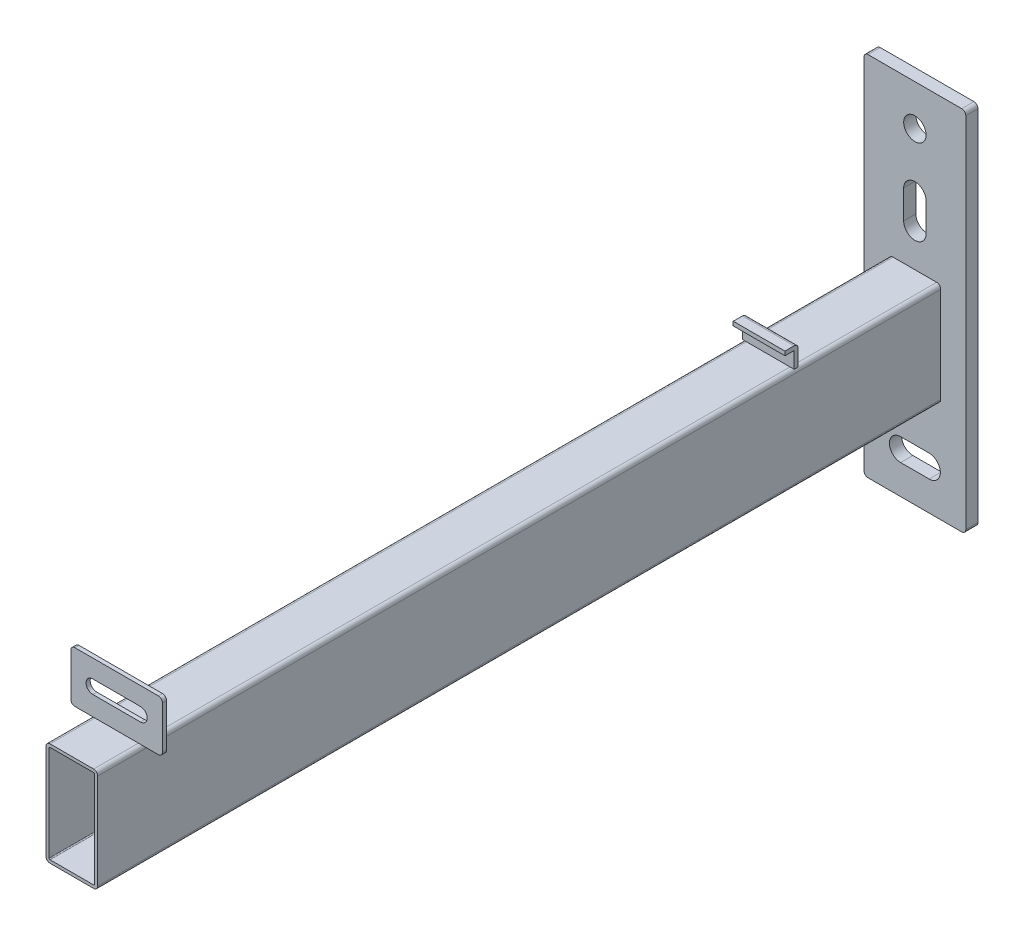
SolidWorks part; units mm, degrees
ref_plane "Front Plane" through (0, 0, 0) normal (0, 0, 1) x (1, 0, 0)
ref_plane "Top Plane" through (0, 0, 0) normal (0, 1, 0) x (1, 0, 0)
ref_plane "Right Plane" through (0, 0, 0) normal (1, 0, 0) x (0, 0, -1)
sketch "Sketch2" plane through (0, 0, 0) normal (1, 0, 0) x (0, 0, -1)
  line L0 (0, 0) -> (-420, 0)
  dimension "D1" = 420
other "Structural Member1"
ref_plane "Plane1" through (0, 0, 0) normal (0, 0, 1) x (1, 0, 0)
sketch "Sketch14" plane through (0, 0, 0) normal (0, 0, 1) x (1, 0, 0)
  line L0 (-10.7, -23.9) -> (10.7, -23.9)
  line L1 (-11.2, -23.4) -> (-11.2, 23.4)
  line L2 (10.7, 23.9) -> (-10.7, 23.9)
  line L3 (11.2, 23.4) -> (11.2, -23.4)
  line L4 (-10.7, -25.4) -> (10.7, -25.4)
  line L5 (-12.7, -23.4) -> (-12.7, 23.4)
  line L6 (10.7, 25.4) -> (-10.7, 25.4)
  line L7 (12.7, 23.4) -> (12.7, -23.4)
  arc A0 (12.7, 23.4) -> (10.7, 25.4) centre (10.7, 23.4) ccw
  arc A1 (10.7, -25.4) -> (12.7, -23.4) centre (10.7, -23.4) ccw
  arc A2 (-12.7, -23.4) -> (-10.7, -25.4) centre (-10.7, -23.4) ccw
  arc A3 (-10.7, 25.4) -> (-12.7, 23.4) centre (-10.7, 23.4) ccw
  arc A4 (-10.7, 23.9) -> (-11.2, 23.4) centre (-10.7, 23.4) ccw
  arc A5 (11.2, 23.4) -> (10.7, 23.9) centre (10.7, 23.4) ccw
  arc A6 (10.7, -23.9) -> (11.2, -23.4) centre (10.7, -23.4) ccw
  arc A7 (-11.2, -23.4) -> (-10.7, -23.9) centre (-10.7, -23.4) ccw
  point P0 (0, 25.4)
  point P1 (12.7, 0)
  point P2 (0, -25.4)
  point P3 (-12.7, 0)
  point P4 (-12.7, 25.4)
  point P5 (12.7, 25.4)
  point P6 (12.7, -25.4)
  point P7 (-12.7, -25.4)
  point P8 (0, 0)
  point P33 (0, 0)
  dimension "D1" = 2
  dimension "D2" = 50.8
  dimension "D3" = 25.4
  dimension "Thickness" = 1.5
sketch "Sketch15" plane through (0, 0, 0) normal (0, 0, 1) x (1, 0, 0)
  line L0 (10.7, 25.4) -> (-10.7, 25.4) construction
  line L1 (23, -74.6) -> (-23, -74.6)
  line L2 (25, -72.6) -> (25, 103.4)
  line L3 (23, 105.4) -> (-23, 105.4)
  line L4 (-25, -72.6) -> (-25, 103.4)
  line L5 (25, -74.6) -> (-25, 105.4) construction
  line L6 (25, 105.4) -> (-25, -74.6) construction
  line L7 (0, 57.4) -> (0, 43.4) construction
  line L8 (5.5, 57.4) -> (5.5, 43.4)
  line L9 (-5.5, 57.4) -> (-5.5, 43.4)
  line L10 (-7, -54.6) -> (7, -54.6) construction
  line L11 (-7, -49.1) -> (7, -49.1)
  line L12 (-7, -60.1) -> (7, -60.1)
  circle A0 centre (0, 85.4) radius 5.5
  arc A1 (5.5, 57.4) -> (-5.5, 57.4) centre (0, 57.4) ccw
  arc A2 (-5.5, 43.4) -> (5.5, 43.4) centre (0, 43.4) ccw
  arc A3 (-7, -49.1) -> (-7, -60.1) centre (-7, -54.6) ccw
  arc A4 (7, -60.1) -> (7, -49.1) centre (7, -54.6) ccw
  arc A5 (-23, -74.6) -> (-25, -72.6) centre (-23, -72.6) cw
  arc A6 (23, -74.6) -> (25, -72.6) centre (23, -72.6) ccw
  arc A7 (25, 103.4) -> (23, 105.4) centre (23, 103.4) ccw
  arc A8 (-23, 105.4) -> (-25, 103.4) centre (-23, 103.4) ccw
  point P0 (0, 15.4)
  point P12 (0, 50.4)
  point P17 (0, -54.6)
  dimension "D4" = 11
  dimension "D7" = 25
  dimension "D8" = 25
  dimension "D12" = 2
  dimension "D1" = 50
  dimension "D2" = 180
  dimension "D3" = 80
  dimension "D5" = 11
  dimension "D6" = 11
  dimension "D9" = 20
  dimension "D10" = 48
  dimension "D11" = 20
extrude "Boss-Extrude1" add sketch "Sketch15" along normal blind 6 separate body
other "Trim/Extend1"
ref_plane "Plane2" through (0, 0, 76) normal (0, 0, 1) x (1, 0, 0)
sketch "Sketch16" plane through (0, 0, 76) normal (0, 0, 1) x (1, 0, 0)
  line L0 (-11.7, 38.2) -> (11.7, 38.2) construction
  line L1 (-20.5, 25.4) -> (20.5, 25.4)
  line L2 (-22.5, 27.4) -> (-22.5, 48.4)
  line L3 (-20.5, 50.4) -> (20.5, 50.4)
  line L4 (22.5, 27.4) -> (22.5, 48.4)
  line L5 (-22.5, 25.4) -> (22.5, 50.4) construction
  line L6 (-22.5, 50.4) -> (22.5, 25.4) construction
  line L7 (-11.7, 41.5) -> (11.7, 41.5)
  line L8 (-11.7, 34.9) -> (11.7, 34.9)
  line L9 (10.7, 25.4) -> (-10.7, 25.4) construction
  arc A0 (-11.7, 41.5) -> (-11.7, 34.9) centre (-11.7, 38.2) ccw
  arc A1 (11.7, 34.9) -> (11.7, 41.5) centre (11.7, 38.2) ccw
  arc A2 (20.5, 25.4) -> (22.5, 27.4) centre (20.5, 27.4) ccw
  arc A3 (20.5, 50.4) -> (22.5, 48.4) centre (20.5, 48.4) cw
  arc A4 (-20.5, 25.4) -> (-22.5, 27.4) centre (-20.5, 27.4) cw
  arc A5 (-22.5, 48.4) -> (-20.5, 50.4) centre (-20.5, 48.4) cw
  point P0 (0, 37.9)
  point P8 (0, 38.2)
  dimension "D4" = 30
  dimension "D5" = 2
  dimension "D1" = 25
  dimension "D2" = 45
  dimension "D3" = 6.6
  dimension "D6" = 9.5
extrude "Boss-Extrude2" [suppressed] add sketch "Sketch16" along normal blind 2 separate body
ref_plane "Plane3" through (0, 0, 396) normal (0, 0, 1) x (1, 0, 0)
sketch "Sketch17" plane through (0, 0, 396) normal (0, 0, 1) x (1, 0, 0)
  line L2 (11.7, 41.5) -> (-11.7, 41.5)
  line L3 (-11.7, 34.9) -> (11.7, 34.9)
  line L4 (11.7, 41.5) -> (-11.7, 41.5)
  line L5 (-11.7, 34.9) -> (11.7, 34.9)
  line L8 (-20.5, 25.4) -> (20.5, 25.4)
  line L9 (22.5, 27.4) -> (22.5, 48.4)
  line L10 (20.5, 50.4) -> (-20.5, 50.4)
  line L11 (-22.5, 48.4) -> (-22.5, 27.4)
  line L12 (-20.5, 25.4) -> (20.5, 25.4)
  line L13 (22.5, 27.4) -> (22.5, 48.4)
  line L14 (20.5, 50.4) -> (-20.5, 50.4)
  line L15 (-22.5, 48.4) -> (-22.5, 27.4)
  arc A2 (11.7, 34.9) -> (11.7, 41.5) centre (11.7, 38.2) ccw
  arc A3 (-11.7, 41.5) -> (-11.7, 34.9) centre (-11.7, 38.2) ccw
  arc A4 (11.7, 34.9) -> (11.7, 41.5) centre (11.7, 38.2) ccw
  arc A5 (-11.7, 41.5) -> (-11.7, 34.9) centre (-11.7, 38.2) ccw
  arc A8 (20.5, 25.4) -> (22.5, 27.4) centre (20.5, 27.4) ccw
  arc A9 (22.5, 48.4) -> (20.5, 50.4) centre (20.5, 48.4) ccw
  arc A10 (-20.5, 50.4) -> (-22.5, 48.4) centre (-20.5, 48.4) ccw
  arc A11 (-22.5, 27.4) -> (-20.5, 25.4) centre (-20.5, 27.4) ccw
  arc A12 (20.5, 25.4) -> (22.5, 27.4) centre (20.5, 27.4) ccw
  arc A13 (22.5, 48.4) -> (20.5, 50.4) centre (20.5, 48.4) ccw
  arc A14 (-20.5, 50.4) -> (-22.5, 48.4) centre (-20.5, 48.4) ccw
  arc A15 (-22.5, 27.4) -> (-20.5, 25.4) centre (-20.5, 27.4) ccw
  dimension "D1" = 0
  dimension "D2" = 0
extrude "Boss-Extrude3" add sketch "Sketch17" along normal blind 2 separate body
ref_plane "Plane4" [suppressed] through (-12.7, 0, 0) normal (-1, 0, 0) x (0, 0, 1)
sketch "Sketch18" [suppressed] plane through (-12.7, 0, 0) normal (-1, 0, 0) x (0, 0, 1)
  line L0 (0, -38.1) -> (0, -641.9)
  line L1 (0, -641.9) -> (428, -641.9)
  line L2 (428, -641.9) -> (428, -38.1)
  line L4 (428, 38.1) -> (0, 38.1) construction
  line L6 (0, 35.1) -> (0, -35.1) construction
  line L7 (428, 35.1) -> (428, -35.1) construction
  dimension "D1" = 680
other "Structural Member2"
ref_plane "Plane5" through (25.4, -38.1, 12.7) normal (0, -1, 0) x (0, 0, 1)
sketch "Sketch111" plane through (25.4, -38.1, 12.7) normal (0, -1, 0) x (0, 0, 1)
  line L0 (-10.7, -36.6) -> (10.7, -36.6)
  line L1 (-11.2, -36.1) -> (-11.2, 36.1)
  line L2 (10.7, 36.6) -> (-10.7, 36.6)
  line L3 (11.2, 36.1) -> (11.2, -36.1)
  line L4 (-10.7, -38.1) -> (10.7, -38.1)
  line L5 (-12.7, -36.1) -> (-12.7, 36.1)
  line L6 (10.7, 38.1) -> (-10.7, 38.1)
  line L7 (12.7, 36.1) -> (12.7, -36.1)
  arc A0 (12.7, 36.1) -> (10.7, 38.1) centre (10.7, 36.1) ccw
  arc A1 (10.7, -38.1) -> (12.7, -36.1) centre (10.7, -36.1) ccw
  arc A2 (-12.7, -36.1) -> (-10.7, -38.1) centre (-10.7, -36.1) ccw
  arc A3 (-10.7, 38.1) -> (-12.7, 36.1) centre (-10.7, 36.1) ccw
  arc A4 (-10.7, 36.6) -> (-11.2, 36.1) centre (-10.7, 36.1) ccw
  arc A5 (11.2, 36.1) -> (10.7, 36.6) centre (10.7, 36.1) ccw
  arc A6 (10.7, -36.6) -> (11.2, -36.1) centre (10.7, -36.1) ccw
  arc A7 (-11.2, -36.1) -> (-10.7, -36.6) centre (-10.7, -36.1) ccw
  point P0 (0, 38.1)
  point P1 (12.7, 0)
  point P2 (0, -38.1)
  point P3 (-12.7, 0)
  point P4 (-12.7, 38.1)
  point P5 (12.7, 38.1)
  point P6 (12.7, -38.1)
  point P7 (-12.7, -38.1)
  point P8 (0, 0)
  point P33 (0, 0)
  dimension "D1" = 2
  dimension "Thickness" = 1.5
  dimension "V_leg" = 76.2
  dimension "H_leg" = 25.4
sketch "Sketch113" [suppressed] plane through (0, 0, 25.4) normal (0, 0, 1) x (1, 0, 0)
  line L0 (-12.7, -641.9) -> (-12.7, -38.1) construction
  line L1 (63.5, -641.9) -> (-12.7, -641.9)
  line L2 (63.5, -641.9) -> (63.5, -635.9)
  line L3 (63.5, -635.9) -> (-12.7, -635.9)
  line L4 (-12.7, -641.9) -> (-12.7, -635.9)
  dimension "D1" = 6
extrude "Boss-Extrude4" [suppressed] add sketch "Sketch113" along normal up to surface (377.2 mm away) separate body
sketch "Sketch112" [suppressed] plane through (0, -635.9, 0) normal (0, 1, 0) x (1, 0, 0)
  line L0 (25.4, -402.6) -> (25.4, -25.4) construction
  line L2 (61.5, -25.4) -> (-10.7, -25.4) construction
  line L4 (63.5, -402.6) -> (-12.7, -402.6) construction
  line L5 (63.5, -25.4) -> (-12.7, -25.4) construction
  circle A0 centre (5.4, -214) radius 5
  circle A1 centre (5.4, -372.6) radius 5
  circle A2 centre (5.4, -55.4) radius 5
  circle A3 centre (45.4, -55.4) radius 5
  circle A4 centre (45.4, -372.6) radius 5
  circle A5 centre (45.4, -214) radius 5
  dimension "D1" = 10
  dimension "D2" = 20
  dimension "D3" = 30
  dimension "D5" = 30
  dimension "D4" = 3
extrude "Cut-Extrude2" [suppressed] cut sketch "Sketch112" against normal blind 30
sketch "Sketch115" plane through (0, 0, 76) normal (0, 0, 1) x (1, 0, 0)
  line L1 (12.7, 25.4) -> (-12.7, 25.4)
  line L2 (12.7, 25.4) -> (12.7, 35.4)
  line L3 (12.7, 35.4) -> (-12.7, 35.4)
  line L4 (-12.7, 25.4) -> (-12.7, 35.4)
  line L6 (10.7, 25.4) -> (-10.7, 25.4) construction
  line L8 (12.7, -23.4) -> (12.7, 23.4) construction
  line L9 (-12.7, 23.4) -> (-12.7, -23.4) construction
  dimension "D1" = 10
extrude "Boss-Extrude5" add sketch "Sketch115" along normal blind 2 separate body
sketch "Sketch117" plane through (0, 0, 78) normal (0, 0, 1) x (1, 0, 0)
  line L0 (12.7, 25.4) -> (12.7, 35.4) construction
  line L1 (-12.7, 35.4) -> (12.7, 35.4)
  line L2 (-12.7, 35.4) -> (-12.7, 33.4)
  line L3 (-12.7, 33.4) -> (12.7, 33.4)
  line L4 (12.7, 35.4) -> (12.7, 33.4)
  dimension "D1" = 2
extrude "Boss-Extrude7" add sketch "Sketch117" along normal blind 4.5
fillet "Fillet1" radius 2 1 edges at (0, 35.4, 76)
sketch "Sketch119" [suppressed] plane through (0, 0, 420) normal (0, 0, 1) x (1, 0, 0)
  line L0 (-10.7, -23.9) -> (10.7, -23.9) construction
  line L1 (11.2, -23.4) -> (11.2, 23.4) construction
  line L2 (-11.2, 23.4) -> (-11.2, -23.4) construction
  line L3 (10.7, 23.9) -> (-10.7, 23.9) construction
  line L4 (10.7, 25.4) -> (-10.7, 25.4)
  line L5 (-12.7, 23.4) -> (-12.7, -23.4)
  line L6 (-10.7, -25.4) -> (10.7, -25.4)
  line L7 (12.7, -23.4) -> (12.7, 23.4)
  line L8 (10.7, 25.4) -> (-10.7, 25.4)
  line L9 (-12.7, 23.4) -> (-12.7, -23.4)
  line L10 (-10.7, -25.4) -> (10.7, -25.4)
  line L11 (12.7, -23.4) -> (12.7, 23.4)
  line L12 (-10.7, -23.9) -> (10.7, -23.9)
  line L13 (11.2, -23.4) -> (11.2, 23.4)
  line L14 (-11.2, 23.4) -> (-11.2, -23.4)
  line L15 (10.7, 23.9) -> (-10.7, 23.9)
  arc A0 (10.7, -23.9) -> (11.2, -23.4) centre (10.7, -23.4) ccw construction
  arc A1 (-11.2, -23.4) -> (-10.7, -23.9) centre (-10.7, -23.4) ccw construction
  arc A2 (11.2, 23.4) -> (10.7, 23.9) centre (10.7, 23.4) ccw construction
  arc A3 (-10.7, 23.9) -> (-11.2, 23.4) centre (-10.7, 23.4) ccw construction
  arc A4 (12.7, 23.4) -> (10.7, 25.4) centre (10.7, 23.4) ccw
  arc A5 (-10.7, 25.4) -> (-12.7, 23.4) centre (-10.7, 23.4) ccw
  arc A6 (-12.7, -23.4) -> (-10.7, -25.4) centre (-10.7, -23.4) ccw
  arc A7 (10.7, -25.4) -> (12.7, -23.4) centre (10.7, -23.4) ccw
  arc A8 (12.7, 23.4) -> (10.7, 25.4) centre (10.7, 23.4) ccw
  arc A9 (-10.7, 25.4) -> (-12.7, 23.4) centre (-10.7, 23.4) ccw
  arc A10 (-12.7, -23.4) -> (-10.7, -25.4) centre (-10.7, -23.4) ccw
  arc A11 (10.7, -25.4) -> (12.7, -23.4) centre (10.7, -23.4) ccw
  arc A12 (10.7, -23.9) -> (11.2, -23.4) centre (10.7, -23.4) ccw
  arc A13 (-11.2, -23.4) -> (-10.7, -23.9) centre (-10.7, -23.4) ccw
  arc A14 (11.2, 23.4) -> (10.7, 23.9) centre (10.7, 23.4) ccw
  arc A15 (-10.7, 23.9) -> (-11.2, 23.4) centre (-10.7, 23.4) ccw
  dimension "D1" = 0
extrude "Boss-Extrude9" [suppressed] add sketch "Sketch119" along normal blind 75
